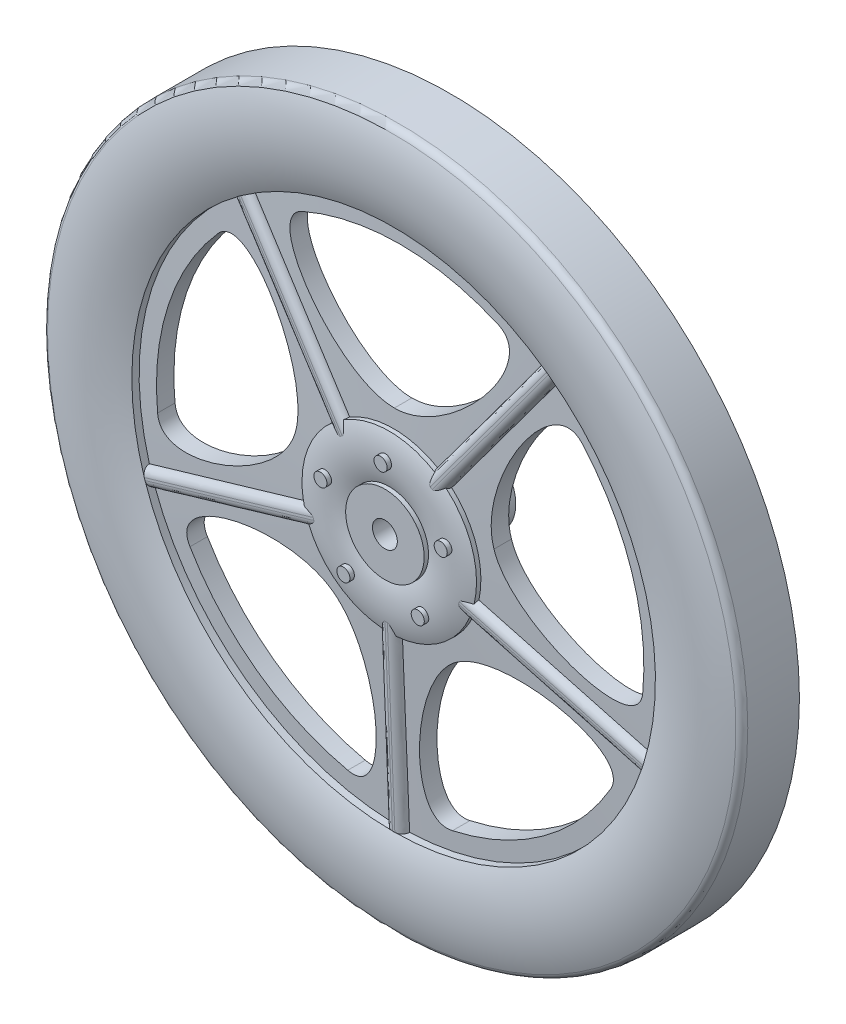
SolidWorks part; units mm, degrees
ref_plane "Plan de face" through (0, 0, 0) normal (0, 0, 1) x (1, 0, 0)
ref_plane "Plan de dessus" through (0, 0, 0) normal (0, 1, 0) x (1, 0, 0)
ref_plane "Plan de droite" through (0, 0, 0) normal (1, 0, 0) x (0, 0, -1)
sketch "Esquisse1" plane through (0, 0, 0) normal (0, 1, 0) x (1, 0, 0)
  line L0 (-9.5432, 0) -> (53.1323, 0) construction
  line L1 (0, 19.7061) -> (0, -20.2019) construction
  line L2 (40, 40.032) -> (40, -8.5517) construction
  line L3 (-12.8761, 10.5) -> (53.1323, 10.5) construction
  line L4 (1.425, 10.8829) -> (1.425, -18.494) construction
  line L5 (4.5, 10.8829) -> (4.5, -18.494) construction
  line L6 (3.1787, 0.5) -> (17.981, 0.5) construction
  line L7 (37.2638, 7.5) -> (65.4001, 7.5) construction
  line L8 (38.1037, 1) -> (66.135, 1) construction
  line L9 (30, 10.5) -> (30, -13.9545) construction
  line L10 (10, 3.3316) -> (10, -9.1026) construction
  line L11 (40, 7.5) -> (40, 1)
  line L12 (35.6933, 1.8333) -> (45.6989, 1.8333) construction
  line L13 (30, 1) -> (30, 1.8333)
  line L14 (3.1787, 1) -> (16.0713, 1) construction
  line L15 (10, 0.5) -> (10, 1)
  line L16 (10, 1) -> (30, 1.8333)
  line L17 (4.5, 0.5) -> (4.5, 0)
  line L18 (4.5, 0) -> (1.425, 0)
  line L19 (8, 2.0486) -> (8, 2.9184)
  line L20 (8, 2.9184) -> (32, 3.9184)
  line L21 (32, 2.417) -> (32, 3.9184)
  line L22 (38, 7.5) -> (38, 2.417)
  line L23 (2.5, 4.4626) -> (2.5, 0) construction
  line L24 (1.425, 0) -> (1.425, 10.5)
  line L25 (1.425, 10.5) -> (4.5, 10.5)
  line L26 (4.5, 10.5) -> (4.5, 2.6917)
  line L27 (38, 7.5) -> (40, 7.5)
  arc A0 (30, 1) -> (40, 1) centre (35, 13) ccw
  arc A1 (4.5, 0.5) -> (10, 0.5) centre (7.25, 7.8124) ccw
  arc A2 (4.5, 2.6917) -> (8, 2.0486) centre (7.25, 7.8124) ccw
  arc A3 (32, 2.417) -> (38, 2.417) centre (35, 13) ccw
  arc A4 (2.5, 4.4626) -> (8, 2.0486) centre (7.25, 7.8124) ccw construction
  dimension "D1" = 2
revolve "Révolution1" add sketch "Esquisse1" angle 360 about L1
sketch "Esquisse2" plane through (0, 0, 0) normal (0, 0, 1) x (1, 0, 0)
  line L0 (0, 0) -> (70.2258, 0) construction
  line L1 (70.2258, 0) -> (0, 0) construction
  line L2 (0, 0) -> (37.7738, 51.9912) construction
  line L3 (0, 0) -> (-43.3396, 59.6518) construction
  line L4 (-4.8541, 3.5267) -> (32.9197, 55.5179) construction
  line L5 (4.8541, 3.5267) -> (-38.4855, 63.1786) construction
  line L6 (0, 0) -> (0, 53.8968) construction
  line L7 (-10.907, 12) -> (26.5978, 12) construction
  arc A1 (-20.8855, 18.5385) -> (-27.7934, -2.7218) centre (0, 0) ccw
  arc A2 (-24.0852, -14.1345) -> (-6, -27.2742) centre (0, 0) ccw
  arc A3 (6, -27.2742) -> (24.0852, -14.1345) centre (0, 0) ccw
  arc A4 (27.7934, -2.7218) -> (20.8855, 18.5385) centre (0, 0) ccw
  arc A5 (11.1772, 25.592) -> (-11.1772, 25.592) centre (0, 0) ccw
  spline S0 degree 3 poles (-11.1772, 25.592) (-16.1875, 23.4883) (-6.6097, 11.956) (0, 11.9996) knots 0 0 0 0 0.949313 0.949313 0.949313 0.949313
  spline S1 degree 3 poles (11.1772, 25.592) (16.1875, 23.4883) (6.6097, 11.956) (0, 11.9996) knots 0 0 0 0 0.949313 0.949313 0.949313 0.949313
  spline S2 degree 3 poles (-27.7934, -2.7218) (-27.341, -8.1369) (-13.4133, -2.5916) (-11.4123, 3.7081) knots 0 0 0 0 0.949313 0.949313 0.949313 0.949313
  spline S3 degree 3 poles (-20.8855, 18.5385) (-17.3365, 22.6535) (-9.3283, 9.9808) (-11.4123, 3.7081) knots 0 0 0 0 0.949313 0.949313 0.949313 0.949313
  spline S4 degree 3 poles (-6, -27.2742) (-0.7101, -28.5172) (-1.6802, -13.5577) (-7.0532, -9.7079) knots 0 0 0 0 0.949313 0.949313 0.949313 0.949313
  spline S5 degree 3 poles (-24.0852, -14.1345) (-26.9021, -9.4877) (-12.3749, -5.7875) (-7.0532, -9.7079) knots 0 0 0 0 0.949313 0.949313 0.949313 0.949313
  spline S6 degree 3 poles (24.0852, -14.1345) (26.9021, -9.4877) (12.3749, -5.7875) (7.0532, -9.7079) knots 0 0 0 0 0.949313 0.949313 0.949313 0.949313
  spline S7 degree 3 poles (6, -27.2742) (0.7101, -28.5172) (1.6802, -13.5577) (7.0532, -9.7079) knots 0 0 0 0 0.949313 0.949313 0.949313 0.949313
  spline S8 degree 3 poles (20.8855, 18.5385) (17.3365, 22.6535) (9.3283, 9.9808) (11.4123, 3.7081) knots 0 0 0 0 0.949313 0.949313 0.949313 0.949313
  spline S9 degree 3 poles (27.7934, -2.7218) (27.341, -8.1369) (13.4133, -2.5916) (11.4123, 3.7081) knots 0 0 0 0 0.949313 0.949313 0.949313 0.949313
  dimension "D1" = 54
  dimension "D2" = 54
  dimension "D4" = 6
extrude "Enlèv. mat.-Extru.1" cut sketch "Esquisse2" against normal through all
sketch "Esquisse3" plane through (0, 0, 0) normal (0, 0, 1) x (1, 0, 0)
  circle A0 centre (0, 0) radius 7.25 construction
  circle A1 centre (0, 7.25) radius 0.75
  circle A2 centre (-6.8952, 2.2404) radius 0.75
  circle A3 centre (-4.2614, -5.8654) radius 0.75
  circle A4 centre (4.2614, -5.8654) radius 0.75
  circle A5 centre (6.8952, 2.2404) radius 0.75
extrude "Extrusion1" add sketch "Esquisse3" along normal mid plane 1
sketch "Esquisse5" plane through (0, 0, 0) normal (1, 0, 0) x (0, 0, -1)
  line L0 (1, -7.8434) -> (1.8333, -29.2843) construction
  line L1 (1, 10) -> (1, -10) construction
  line L2 (1.8333, -30) -> (1.8333, 30) construction
  line L3 (0.0662, -6.7122) -> (1.0036, -30.0527)
  line L4 (1.0036, -30.0527) -> (1.9033, -30.4468)
  line L5 (1.9033, -30.4468) -> (1.1546, -6.7122)
  line L6 (1.1546, -6.7122) -> (0.0662, -6.7122)
extrude "Extrusion2" add sketch "Esquisse5" along normal mid plane 2
fillet "Congé variable2" radius 0.866 10 edges at (-1, -29.9833, -1.4171) (0, -30, -1.0015) (1, -29.9833, -1.4171) (-1, -19.3392, -0.5733) (1, -9.9499, -0.75) (1, 9.6541, -15.2288) (1, -19.3392, -0.5733) (-1, -9.9499, -0.75) (-1, 9.6541, -15.2288)
pattern_circular "Répétition circulaire1" count 5 every 72 about axis through (0, 0, -19.7061) along (0, 0, 1) of "Extrusion2", "Congé variable2"
fillet "Congé1" radius 0.85 1 edges at (-40, 0, -1)
